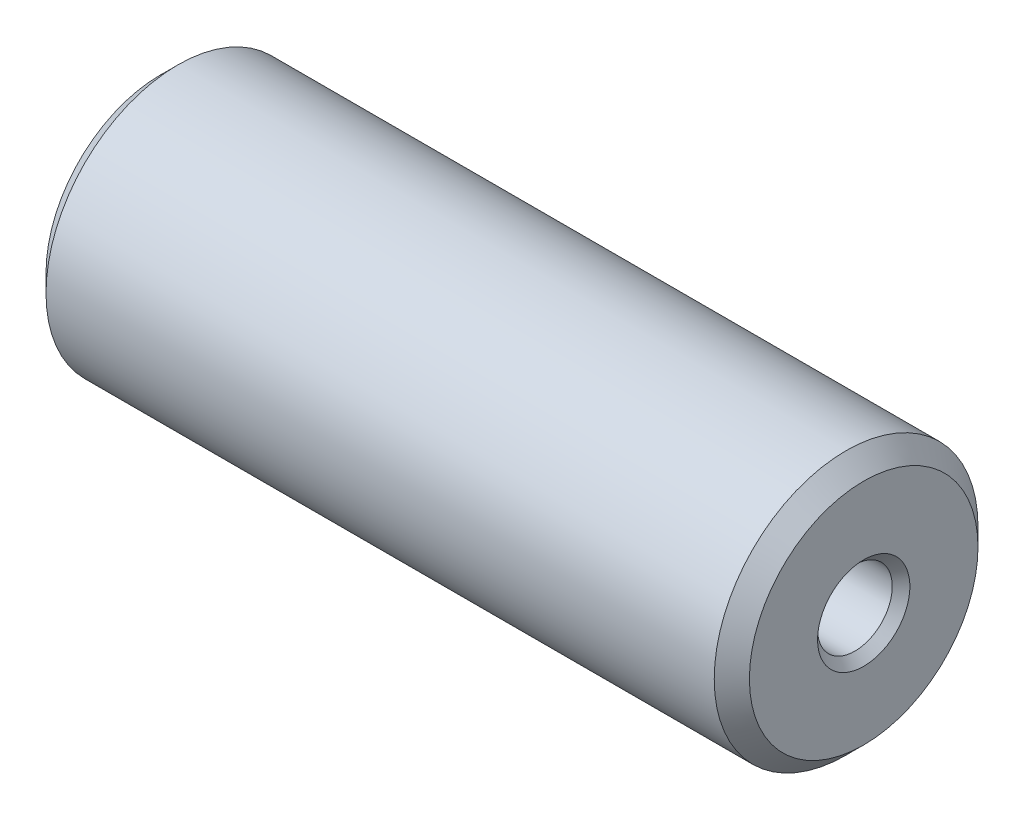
SolidWorks part; units mm, degrees
ref_plane "Спереди" through (0, 0, 0) normal (0, 0, 1) x (1, 0, 0)
ref_plane "Сверху" through (0, 0, 0) normal (0, 1, 0) x (1, 0, 0)
ref_plane "Справа" through (0, 0, 0) normal (1, 0, 0) x (0, 0, -1)
sketch "Эскиз1" plane through (0, 0, 0) normal (0, 0, 1) x (1, 0, 0)
  line L1 (0, 0) -> (80, 0)
  line L2 (0, 0) -> (0, 15)
  line L3 (0, 15) -> (80, 15)
  line L4 (80, 0) -> (80, 15)
  dimension "D1" = 15
  dimension "D2" = 80
revolve "Повернуть1" add sketch "Эскиз1" angle 360 about L1
sketch "Эскиз2" plane through (0, 0, 0) normal (-1, 0, 0) x (0, 0, 1)
  circle A0 centre (0, 0) radius 4.25
  dimension "D1" = 8.5
extrude "Вырез-Вытянуть1" cut sketch "Эскиз2" against normal through all
chamfer "Фаска1" distance 1 angle 45 2 edges at (80, 0, 4.25) (0, 0, 4.25)
chamfer "Фаска2" distance 2 angle 45 2 edges at (80, 0, 15) (0, 0, 15)
